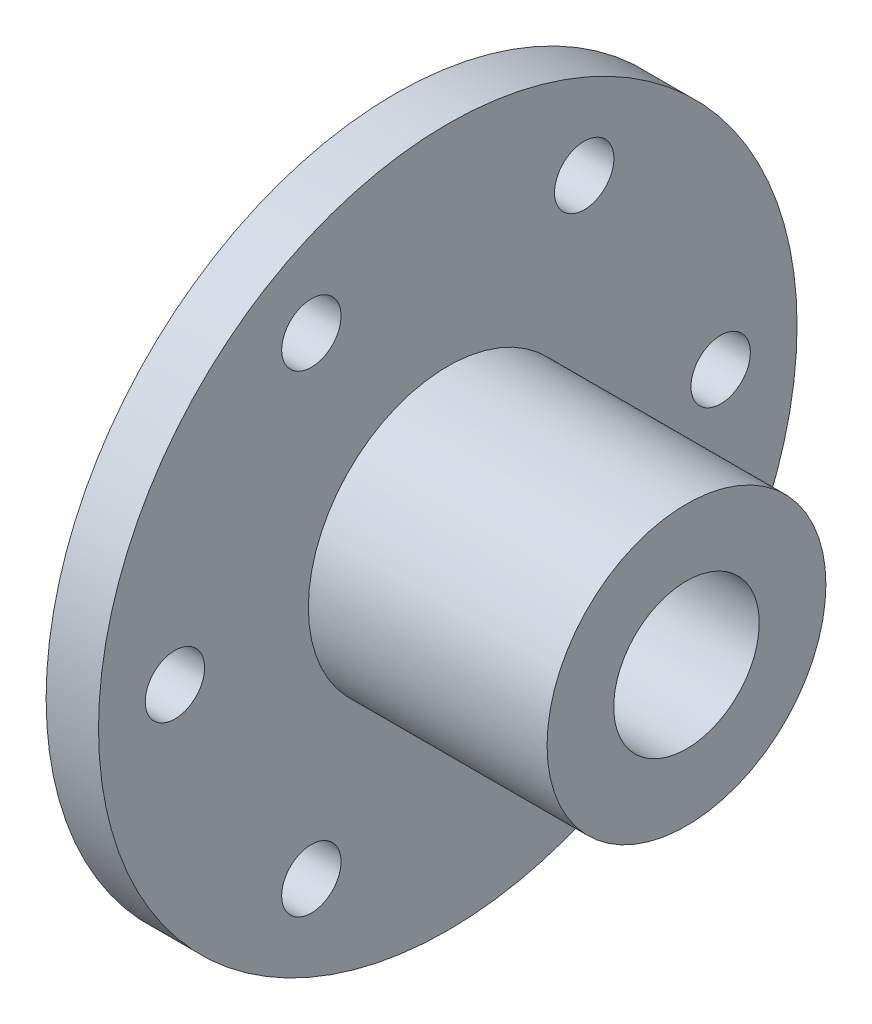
SolidWorks part; units mm, degrees
ref_plane "Front Plane" through (0, 0, 0) normal (0, 0, 1) x (1, 0, 0)
ref_plane "Top Plane" through (0, 0, 0) normal (0, 1, 0) x (1, 0, 0)
ref_plane "Right Plane" through (0, 0, 0) normal (1, 0, 0) x (0, 0, -1)
ref_plane "Plane1" through (0, 0, 0) normal (0, 0, -1) x (-1, 0, 0)
sketch "Sketch1" plane through (0, 0, 0) normal (0, 0, -1) x (-1, 0, 0)
  line L0 (13.0351, 30.48) -> (13.0351, 0)
  line L1 (13.0351, 0) -> (17.6071, 0)
  line L2 (17.6071, 0) -> (17.6071, 30.48)
  line L3 (17.6071, 30.48) -> (13.0351, 30.48)
  line L4 (13.0351, 0) -> (17.6071, 0) construction
revolve "Revolve1" add sketch "Sketch1" angle 360 about L4
sketch "Sketch2" plane through (-13.0351, 0, 0) normal (1, 0, 0) x (0, 0, -1)
  circle A0 centre (0, 0) radius 12.1666
extrude "Boss-Extrude1" add sketch "Sketch2" along normal blind 20.828
sketch "Sketch3" plane through (-17.6071, 0, 0) normal (-1, 0, 0) x (0, 0, 1)
  line L0 (5.4993, 0) -> (2.7496, 4.7625)
  line L1 (2.7496, 4.7625) -> (-2.7496, 4.7625)
  line L2 (-2.7496, 4.7625) -> (-5.4993, 0)
  line L3 (-5.4993, 0) -> (-2.7496, -4.7625)
  line L4 (-2.7496, -4.7625) -> (2.7496, -4.7625)
  line L5 (2.7496, -4.7625) -> (5.4993, 0)
extrude "Cut-Extrude1" cut sketch "Sketch3" against normal through all
hole_wizard "Hole1" positions "Sketch5" profile "Sketch4" legacy
sketch "Sketch5" plane through (-17.6071, 0, 0) normal (-1, 0, 0) x (0, 0, 1)
  point P0 (23.8125, 0)
  point P1 (11.9062, -20.6222)
  point P2 (-11.9063, -20.6222)
  point P3 (-23.8125, 0)
  point P4 (-11.9063, 20.6222)
  point P5 (11.9063, 20.6222)
sketch "Sketch4" plane through (-17.6071, 0, 23.8125) normal (0, 1, 0) x (0, 0, 1)
  line L0 (0, 0) -> (0, 25.4)
  line L1 (0, 25.4) -> (2.5908, 25.4)
  line L2 (2.5908, 25.4) -> (2.5908, 0)
  line L3 (2.5908, 0) -> (0, 0)
  line L4 (0, 110) -> (0, -10) construction
  dimension "Diameter" = 5.1816
  dimension "Depth" = 25.4
sketch "Sketch6" plane through (7.7929, 0, 0) normal (1, 0, 0) x (0, 0, -1)
  circle A0 centre (0, 0) radius 6.35
  dimension "D1" = 12.7
extrude "Cut-Extrude2" cut sketch "Sketch6" against normal through all
